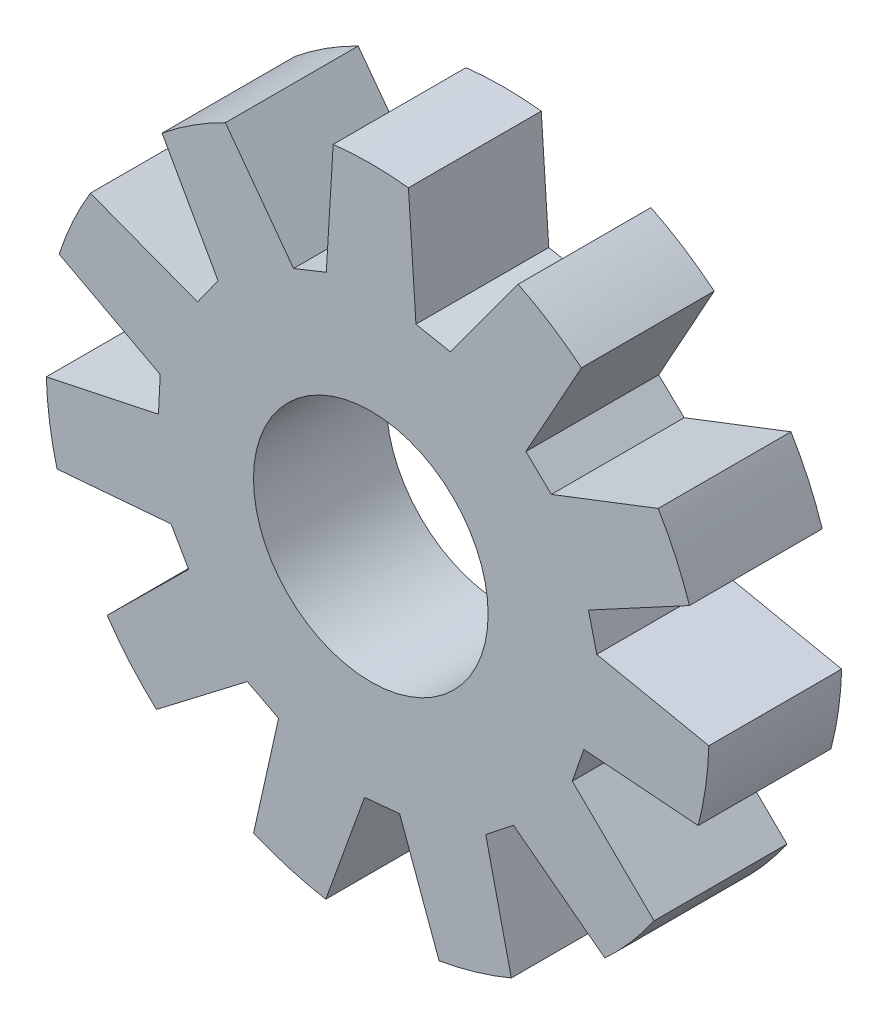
SolidWorks part; units mm, degrees
ref_plane "Front Plane" through (0, 0, 0) normal (0, 0, 1) x (1, 0, 0)
ref_plane "Top Plane" through (0, 0, 0) normal (0, 1, 0) x (1, 0, 0)
ref_plane "Right Plane" through (0, 0, 0) normal (1, 0, 0) x (0, 0, -1)
sketch "Sketch2" plane through (0, 0, 0) normal (0, 0, 1) x (1, 0, 0)
  line L0 (-0.1341, 7.485) -> (-0.1341, -2.6532) construction
  line L1 (4.6228, 5.869) -> (3.3686, 3.6041)
  line L2 (3.1926, 6.7881) -> (1.6669, 4.7016)
  line L3 (7.0619, 2.4381) -> (4.7824, 1.2108)
  line L4 (6.3557, 3.9844) -> (3.9442, 3.054)
  line L5 (7.259, -1.767) -> (4.6778, -1.567)
  line L6 (7.5009, -0.0843) -> (4.9692, 0.4368)
  line L7 (-0.9841, 7.4366) -> (-1.1396, 4.8565)
  line L8 (0.7159, 7.4366) -> (0.8853, 4.8532)
  line L9 (5.1514, -5.411) -> (3.088, -3.8472)
  line L10 (6.2646, -4.1262) -> (4.4165, -2.3191)
  line L11 (1.4082, -7.337) -> (0.5178, -4.906)
  line L12 (3.0394, -6.8581) -> (2.4616, -4.3387)
  line L13 (-2.782, -6.9337) -> (-2.2168, -4.4072)
  line L14 (-1.1509, -7.4126) -> (-0.2748, -4.9808)
  line L15 (-6.089, -4.3289) -> (-4.2476, -2.5091)
  line L16 (-4.9757, -5.6137) -> (-2.924, -4.0415)
  line L17 (-7.4628, -0.3497) -> (-4.9298, 0.1856)
  line L18 (-7.2208, -2.0324) -> (-4.6448, -1.8191)
  line L19 (-6.4672, 3.7405) -> (-4.0468, 2.8214)
  line L20 (-7.1734, 2.1941) -> (-4.891, 0.9808)
  line L21 (-3.4183, 6.6431) -> (-1.8791, 4.5614)
  line L22 (-4.8484, 5.724) -> (-3.5843, 3.4694)
  line L23 (0.8853, 4.8532) -> (1.6669, 4.7016)
  line L24 (3.3686, 3.6041) -> (3.9442, 3.054)
  line L25 (4.7824, 1.2108) -> (4.9692, 0.4368)
  line L26 (4.6778, -1.567) -> (4.4165, -2.3191)
  line L28 (3.088, -3.8472) -> (2.4616, -4.3387)
  line L29 (0.5178, -4.906) -> (-0.2748, -4.9808)
  line L30 (-2.2168, -4.4072) -> (-2.924, -4.0415)
  line L31 (-4.2476, -2.5091) -> (-4.6448, -1.8191)
  line L32 (-4.9298, 0.1856) -> (-4.891, 0.9808)
  line L33 (-4.0468, 2.8214) -> (-3.5843, 3.4694)
  line L34 (-1.8791, 4.5614) -> (-1.1396, 4.8565)
  arc A0 (4.6228, 5.869) -> (3.1926, 6.7881) centre (-0.1145, 0.0698) ccw
  arc A1 (7.0619, 2.4381) -> (6.3557, 3.9844) centre (-0.0586, 0.1207) ccw
  arc A2 (7.259, -1.767) -> (7.5009, -0.0843) centre (0.016, 0.1332) ccw
  arc A3 (5.1514, -5.411) -> (6.2646, -4.1262) centre (0.0854, 0.1034) ccw
  arc A4 (1.4082, -7.337) -> (3.0394, -6.8581) centre (0.1278, 0.0408) ccw
  arc A5 (-2.782, -6.9337) -> (-1.1509, -7.4126) centre (0.1296, -0.0347) ccw
  arc A6 (-6.089, -4.3289) -> (-4.9757, -5.6137) centre (0.0902, -0.0993) ccw
  arc A7 (-7.4628, -0.3497) -> (-7.2208, -2.0324) centre (0.0222, -0.1323) ccw
  arc A8 (-6.4672, 3.7405) -> (-7.1734, 2.1941) centre (-0.0528, -0.1233) ccw
  circle A9 centre (-0.1341, -0.0032) radius 2.65
  arc A10 (-3.4183, 6.6431) -> (-4.8484, 5.724) centre (-0.1111, -0.0752) ccw
  arc A17 (0.7159, 7.4366) -> (-0.9841, 7.4366) centre (-0.1341, -0.0032) ccw
  point P49 (0.0051, -0.0007)
  point P59 (0, 0)
  point P63 (0, 0)
  dimension "D1" = 5.3
  dimension "D2" = 1.7
  dimension "D3" = 11
extrude "Boss-Extrude1" add sketch "Sketch2" along normal blind 3
